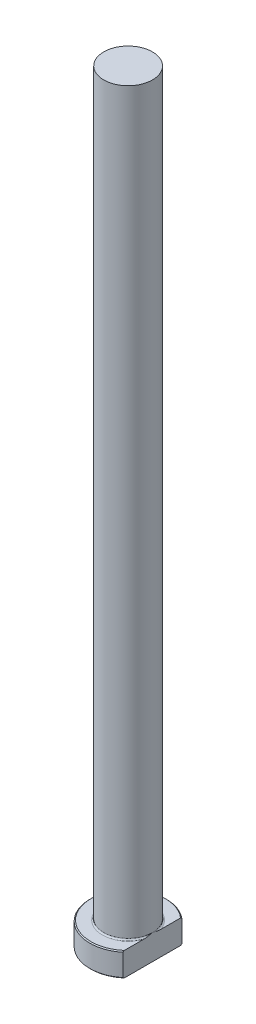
SolidWorks part; units mm, degrees
ref_plane "Front Plane" through (0, 0, 0) normal (0, 0, 1) x (1, 0, 0)
ref_plane "Top Plane" through (0, 0, 0) normal (0, 1, 0) x (1, 0, 0)
ref_plane "Right Plane" through (0, 0, 0) normal (1, 0, 0) x (0, 0, -1)
sketch "Sketch1" plane through (0, 0, 0) normal (0, 0, 1) x (1, 0, 0)
  line L0 (0, 259.9588) -> (0, -15.1925) construction
  line L1 (0, 0) -> (-8, 0)
  line L2 (-8, 0) -> (-8, 5)
  line L3 (-8, 5) -> (-5.1, 5)
  line L4 (-5.1, 5) -> (-5.1, 160)
  line L5 (-5.1, 160) -> (0, 160)
  line L6 (0, 160) -> (0, 0)
  dimension "L" = 160
  dimension "H" = 16
  dimension "T" = 5
  dimension "D" = 10.2
revolve "Revolve1" add sketch "Sketch1" angle 360 about L0
chamfer "Chamfer1" distance 0.2 angle 45 2 edges at (0, 5, 8) (0, 0, 8)
fillet "Fillet1" radius 0.3 1 edges at (0, 5, 5.1)
sketch "Sketch2" plane through (0, 0, 0) normal (0, 1, 0) x (1, 0, 0)
  line L0 (5.1, 6.1636) -> (5.1, -6.1636)
  circle A0 centre (0, 0) radius 8 construction
  arc A1 (5.1, -6.1636) -> (5.1, 6.1636) centre (0, 0) ccw
  circle A2 centre (0, 0) radius 5.1 construction
extrude "KEY" cut sketch "Sketch2" along normal through all
